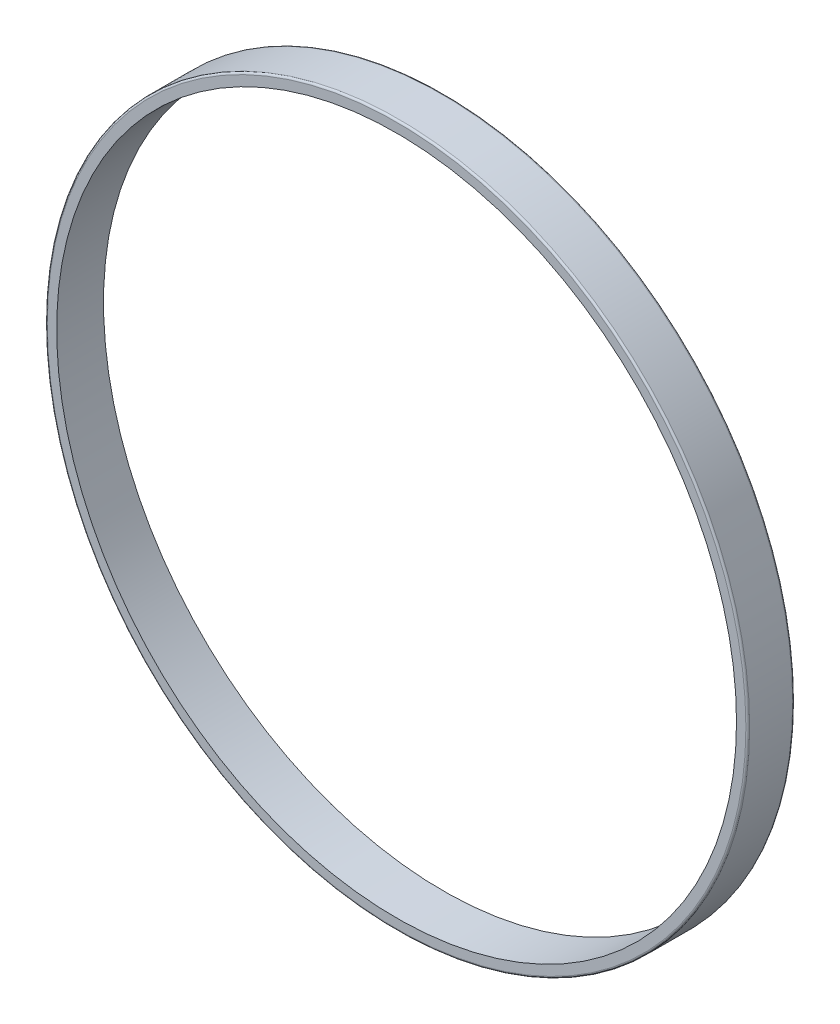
SolidWorks part; units mm, degrees
ref_plane "前视基准面" through (0, 0, 0) normal (0, 0, 1) x (1, 0, 0)
ref_plane "上视基准面" through (0, 0, 0) normal (0, 1, 0) x (1, 0, 0)
ref_plane "右视基准面" through (0, 0, 0) normal (1, 0, 0) x (0, 0, -1)
sketch "草图1" plane through (0, 0, 0) normal (0, 0, 1) x (1, 0, 0)
  circle A0 centre (0, 0) radius 37.5
  circle A1 centre (0, 0) radius 36.3
  dimension "D1" = 75
  dimension "D2" = 1.2
extrude "凸台-拉伸1" add sketch "草图1" along normal blind 5
fillet "圆角1" radius 0.2 2 edges at (37.5, 0, 0) (37.5, 0, 5)
